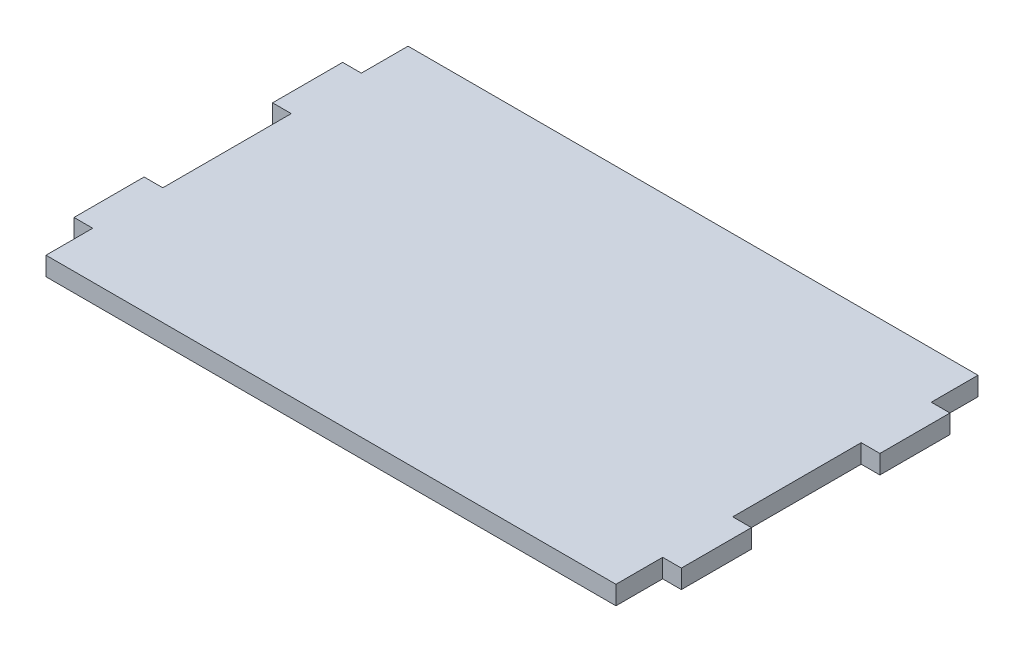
SolidWorks part; units mm, degrees
ref_plane "Ebene vorne" through (0, 0, 0) normal (0, 0, 1) x (1, 0, 0)
ref_plane "Ebene oben" through (0, 0, 0) normal (0, 1, 0) x (1, 0, 0)
ref_plane "Ebene rechts" through (0, 0, 0) normal (1, 0, 0) x (0, 0, -1)
sketch "Skizze2" plane through (0, 0, 0) normal (0, 1, 0) x (1, 0, 0)
  line L0 (-74.6062, 0) -> (112.5525, 0) construction
  line L1 (0, 76.8215) -> (0, -83.6429) construction
  line L3 (-61, 38.75) -> (61, 38.75)
  line L4 (-61, -28.75) -> (-61, -38.75)
  line L5 (-61, -38.75) -> (61, -38.75)
  line L6 (65, 28.75) -> (65, 13.75)
  line L9 (61, 38.75) -> (61, 28.75)
  line L10 (61, 28.75) -> (65, 28.75)
  line L11 (61, 13.75) -> (65, 13.75)
  line L12 (61, -28.75) -> (61, -38.75)
  line L13 (61, -13.75) -> (65, -13.75)
  line L14 (61, -28.75) -> (65, -28.75)
  line L15 (65, -28.75) -> (65, -13.75)
  line L16 (61, 13.75) -> (61, -13.75)
  line L17 (-61, 28.75) -> (-65, 28.75)
  line L18 (-65, 28.75) -> (-65, 13.75)
  line L19 (-61, -13.75) -> (-65, -13.75)
  line L20 (-65, -28.75) -> (-65, -13.75)
  line L21 (-61, 38.75) -> (-61, 28.75)
  line L22 (-61, 13.75) -> (-61, -13.75)
  line L23 (-65, 13.75) -> (-61, 13.75)
  line L24 (-65, -28.75) -> (-61, -28.75)
  dimension "D2" = 130
  dimension "D10" = 4
  dimension "D11" = 10
  dimension "D12" = 15
  dimension "D13" = 77.5
extrude "Aufsatz-Linear austragen1" add sketch "Skizze2" along normal blind 4
